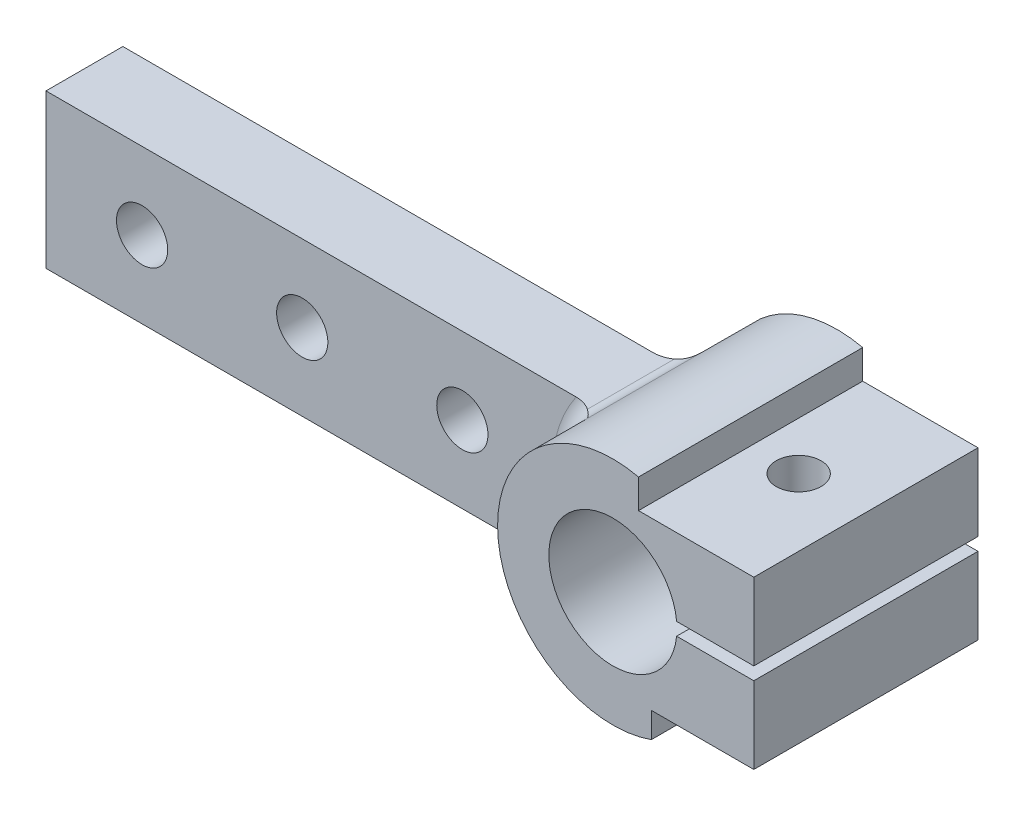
SolidWorks part; units mm, degrees
ref_plane "Plan1" through (0, 0, 0) normal (0, 0, 1) x (1, 0, 0)
ref_plane "Plan2" through (0, 0, 0) normal (0, 1, 0) x (1, 0, 0)
ref_plane "Plan3" through (0, 0, 0) normal (1, 0, 0) x (0, 0, -1)
sketch "Esquisse1" plane through (0, 0, 0) normal (0, 0, 1) x (1, 0, 0)
  circle A0 centre (0, 0) radius 18
  dimension "D1" = 36
extrude "Base-Extrusion" add sketch "Esquisse1" along normal mid plane 35
sketch "Esquisse2" plane through (0, 0, 0) normal (0, 0, 1) x (1, 0, 0)
  line L1 (22, 14) -> (0, 14)
  line L2 (22, 14) -> (22, -14)
  line L3 (22, -14) -> (0, -14)
  line L4 (0, 14) -> (0, -14)
  dimension "D1" = 28
  dimension "D2" = 22
extrude "Boss.-Extru.3" add sketch "Esquisse2" along normal mid plane 35
sketch "Esquisse3" plane through (0, 0, 0) normal (0, 1, 0) x (1, 0, 0)
  line L1 (-50, 0) -> (50, 0) construction
  circle A0 centre (11.5, 0) radius 3.5
  dimension "D1" = 7
  dimension "D2" = 11.5
extrude "Enlèv. mat.-Extru.1" cut sketch "Esquisse3" against normal through all and the other way through all
sketch "Esquisse4" plane through (0, 0, 0) normal (0, 0, 1) x (1, 0, 0)
  line L1 (0, 12) -> (-100, 12)
  line L2 (0, 12) -> (0, -12)
  line L3 (0, -12) -> (-100, -12)
  line L4 (-100, 12) -> (-100, -12)
  dimension "D1" = 24
  dimension "D2" = 100
extrude "Boss.-Extru.4" add sketch "Esquisse4" along normal mid plane 12
sketch "Esquisse5" plane through (0, 0, -17.5) normal (0, 0, -1) x (-1, 0, 0)
  circle A0 centre (0, 0) radius 10
  dimension "D1" = 20
extrude "Enlèv. mat.-Extru.2" cut sketch "Esquisse5" against normal through all
sketch "Esquisse6" plane through (0, 0, -17.5) normal (0, 0, -1) x (-1, 0, 0)
  line L0 (-22, -14) -> (-22, 14) construction
  line L1 (-22, 13) -> (-4, 13)
  line L2 (-22, 13) -> (-22, 18)
  line L3 (-22, 18) -> (-4, 18)
  line L4 (-4, 13) -> (-4, 18)
  arc A0 (-11.3137, -14) -> (-11.3137, 14) centre (0, 0) ccw construction
  dimension "D1" = 18
  dimension "D2" = 13
extrude "Enlèv. mat.-Extru.3" cut sketch "Esquisse6" against normal through all
sketch "Esquisse7" plane through (0, 0, -17.5) normal (0, 0, -1) x (-1, 0, 0)
  line L0 (-22, -14) -> (-22, 13) construction
  line L1 (-22, -13) -> (-6, -13)
  line L2 (-22, -13) -> (-22, -18)
  line L3 (-22, -18) -> (-6, -18)
  line L4 (-6, -13) -> (-6, -18)
  arc A0 (-11.3137, -14) -> (-4, 17.5499) centre (0, 0) ccw construction
  dimension "D1" = 13
  dimension "D2" = 16
extrude "Enlèv. mat.-Extru.4" cut sketch "Esquisse7" against normal through all
sketch "Esquisse8" plane through (0, 0, -17.5) normal (0, 0, -1) x (-1, 0, 0)
  line L0 (-22, -13) -> (-22, 13) construction
  line L1 (-22, 1) -> (0, 1)
  line L2 (-22, 1) -> (-22, -1)
  line L3 (-22, -1) -> (0, -1)
  line L4 (0, 1) -> (0, -1)
  dimension "D1" = 2
extrude "Enlèv. mat.-Extru.5" cut sketch "Esquisse8" against normal through all
fillet "Congé1" radius 3
hole_wizard "Perçage1" positions "Esquisse10" profile "Esquisse9" tap size "M8x1.25" standard "Ansi Métrique"
sketch "Esquisse10" plane through (0, 0, -6) normal (0, 0, -1) x (-1, 0, 0)
  line L0 (50, 0) -> (-50, 0) construction
  point P0 (85, 0)
  dimension "D1" = 85
sketch "Esquisse9" plane through (-85, 0, -6) normal (1, 0, 0) x (0, 1, 0)
  line L0 (0, 0) -> (0, 23.5)
  line L1 (0, 23.5) -> (4, 23.5)
  line L2 (4, 23.5) -> (4, 0)
  line L5 (4, 0) -> (0, 0)
  line L11 (0, -6.35) -> (0, 107.95) construction
  dimension "Diamètre du perçage jusqu'au prochain" = 8
  dimension "Profondeur du perçage jusqu'au prochain" = 23.5
pattern_linear "Répétition linéaire1" count 3 spacing 25
